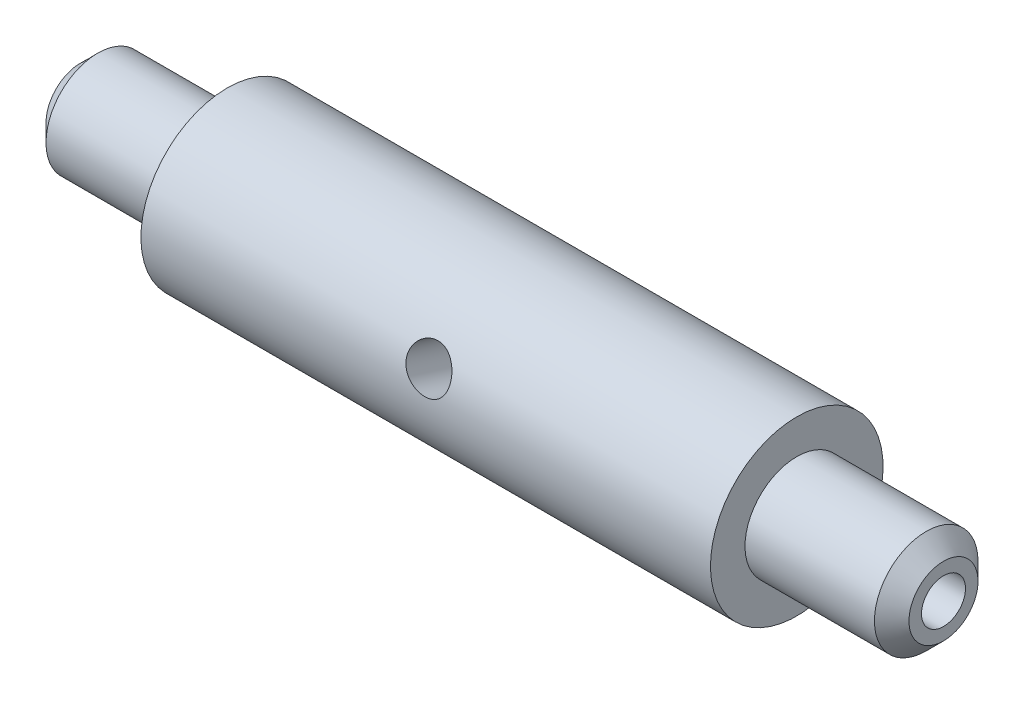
SolidWorks part; units mm, degrees
other "Markup1"
sketch "Sketch11" plane through (-59.7322, -10, 10) normal (-0.0941, -0.9454, 0.312) x (0.966, -0.0109, 0.2583)
ref_plane "Front Plane" through (0, 0, 0) normal (0, 0, 1) x (1, 0, 0)
ref_plane "Top Plane" through (0, 0, 0) normal (0, 1, 0) x (1, 0, 0)
ref_plane "Right Plane" through (0, 0, 0) normal (1, 0, 0) x (0, 0, -1)
sketch "Sketch1" plane through (0, 0, 0) normal (0, 0, 1) x (1, 0, 0)
  line L0 (0, 0) -> (-27.3072, 0) construction
  line L1 (-42.7322, 0) -> (-59.7322, 0)
  line L2 (-42.7322, 0) -> (23.2678, 0)
  line L3 (-42.7322, 0) -> (-42.7322, 10)
  line L4 (-42.7322, 10) -> (23.2678, 10)
  line L5 (23.2678, 0) -> (23.2678, 10)
  line L6 (-42.7322, 6) -> (-59.7322, 6)
  line L7 (-42.7322, 6) -> (-42.7322, 0)
  line L8 (-42.7322, 0) -> (-59.7322, 0)
  line L9 (-59.7322, 6) -> (-59.7322, 0)
  line L10 (23.2678, 6) -> (40.2678, 6)
  line L11 (23.2678, 6) -> (23.2678, 0)
  line L12 (23.2678, 0) -> (40.2678, 0)
  line L13 (40.2678, 6) -> (40.2678, 0)
  line L14 (23.2678, 0) -> (40.2678, 0)
  dimension "D1" = 66
  dimension "D2" = 17
  dimension "D3" = 17
  dimension "D4" = 10
  dimension "D5" = 6
  dimension "D6" = 6
revolve "Revolve5" add sketch "Sketch1" angle 360 about L0
chamfer "Chamfer1" distance 2 angle 45 1 edges at (-59.7322, 6, 0)
chamfer "Chamfer2" distance 2 angle 45 1 edges at (40.2678, 6, 0)
hole_wizard "Ø5.0mm Dowel Hole3" positions "3DSketch7" profile "Sketch8" hole size "Ø5.0" standard "AS"
sketch3d "3DSketch7"
  line L0 (38.2678, 0, 0) -> (40.2678, 0, 0) construction
  point P0 (40.2678, 0, 0)
sketch "Sketch8" plane through (40.2678, 0, 0) normal (0, 1, 0) x (0, 0, -1)
  line L0 (0, 0) -> (0, 50)
  line L1 (0, 50) -> (2.55, 48.4678)
  line L2 (2.55, 48.4678) -> (2.55, 0)
  line L5 (2.55, 0) -> (0, 0)
  line L10 (0, 50) -> (-2.55, 48.4678) construction
  line L11 (0, -6.35) -> (0, 107.95) construction
  dimension "Hole Dia." = 5.1
  dimension "Hole Depth" = 50
  dimension "Drill Angle" = 118
hole_wizard "Ø5.0mm Dowel Hole4" positions "3DSketch9" profile "Sketch10" hole size "Ø5.0" standard "AS"
sketch3d "3DSketch9"
  line L0 (-59.7322, 0, 0) -> (52.5757, 0, 0) construction
  line L1 (-57.7322, 0, 0) -> (-59.7322, 0, 0) construction
  line L2 (-8.2, 0, 0) -> (40.2678, 0, 0) construction
  line L3 (38.2678, 0, 0) -> (40.2678, 0, 0) construction
  point P0 (-9.7322, 0, 0)
  point P3 (-9.8432, 2.9863, 9.5437)
sketch "Sketch10" plane through (-9.8432, 2.9863, 9.5437) normal (1, 0, 0) x (0, -0.9544, 0.2986)
  line L0 (0, 0) -> (0, 14)
  line L1 (0, 14) -> (2.55, 12.4678)
  line L2 (2.55, 12.4678) -> (2.55, 0)
  line L5 (2.55, 0) -> (0, 0)
  line L10 (0, 14) -> (-2.55, 12.4678) construction
  line L11 (0, -6.35) -> (0, 107.95) construction
  dimension "Hole Dia." = 5.1
  dimension "Hole Depth" = 14
  dimension "Drill Angle" = 118
